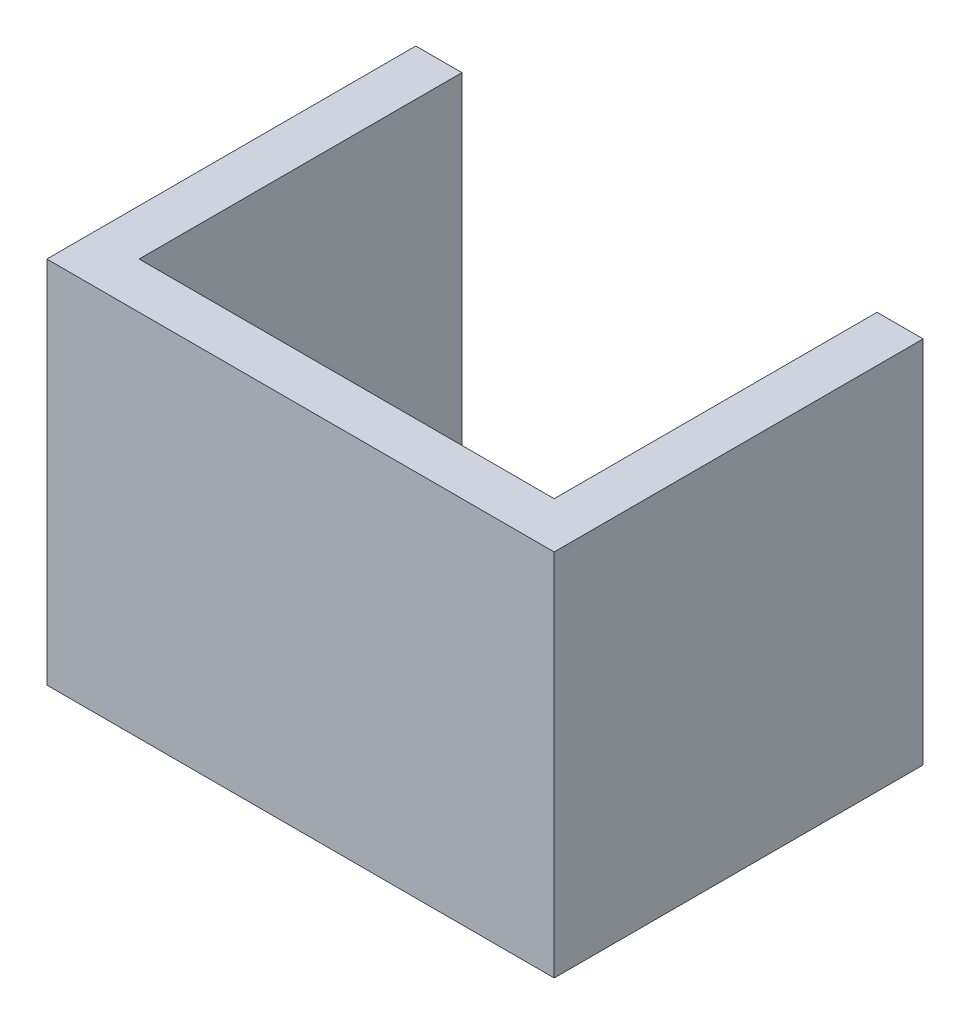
SolidWorks part; units mm, degrees
ref_plane "Front Plane" through (0, 0, 0) normal (0, 0, 1) x (1, 0, 0)
ref_plane "Top Plane" through (0, 0, 0) normal (0, 1, 0) x (1, 0, 0)
ref_plane "Right Plane" through (0, 0, 0) normal (1, 0, 0) x (0, 0, -1)
sketch "Sketch1" plane through (0, 0, 0) normal (0, 1, 0) x (1, 0, 0)
  line L0 (0, 0) -> (254, 0)
  line L1 (254, 0) -> (254, 203.2)
  line L2 (254, 203.2) -> (228.6, 203.2)
  line L3 (228.6, 203.2) -> (228.6, 25.4)
  line L4 (228.6, 25.4) -> (0, 25.4)
  line L6 (0, 0) -> (-25.4, 0)
  line L7 (-25.4, 0) -> (-25.4, 203.2)
  line L8 (-25.4, 203.2) -> (0, 203.2)
  line L9 (0, 203.2) -> (0, 25.4)
  dimension "D1" = 254
  dimension "D2" = 203.2
  dimension "D3" = 25.4
  dimension "D4" = 25.4
  dimension "D5" = 25.4
  dimension "D6" = 203.2
  dimension "D7" = 279.4
extrude "Boss-Extrude1" add sketch "Sketch1" along normal blind 203.2
